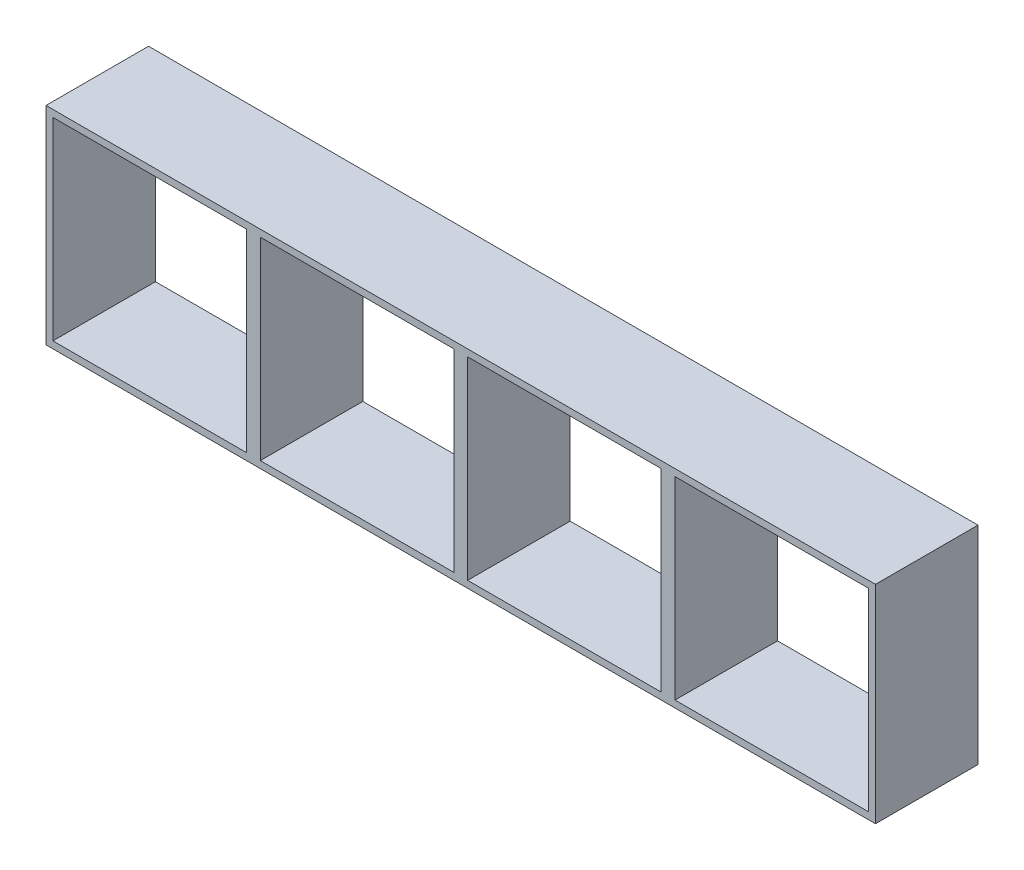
SolidWorks part; units mm, degrees
ref_plane "Plan de face" through (0, 0, 0) normal (0, 0, 1) x (1, 0, 0)
ref_plane "Plan de dessus" through (0, 0, 0) normal (0, 1, 0) x (1, 0, 0)
ref_plane "Plan de droite" through (0, 0, 0) normal (1, 0, 0) x (0, 0, -1)
sketch "Esquisse1" plane through (0, 0, 0) normal (0, 0, 1) x (1, 0, 0)
  line L0 (0, 0) -> (0, 30)
  line L16 (59, 1) -> (59, 29)
  line L17 (59, 29) -> (31, 29)
  line L18 (31, 29) -> (31, 1)
  line L20 (29, 1) -> (29, 29)
  line L21 (29, 29) -> (1, 29)
  line L22 (1, 29) -> (1, 1)
  line L24 (0, 30) -> (120, 30)
  line L25 (60, 30) -> (60, 1) construction
  line L27 (119, 29) -> (119, 1)
  line L28 (91, 29) -> (119, 29)
  line L29 (91, 1) -> (91, 29)
  line L31 (89, 29) -> (89, 1)
  line L32 (61, 29) -> (89, 29)
  line L33 (61, 1) -> (61, 29)
  line L34 (120, 0) -> (120, 30)
  line L35 (0, 0) -> (120, 0)
  line L36 (1, 1) -> (29, 1)
  line L37 (29, 29) -> (31, 29) construction
  line L38 (59, 29) -> (61, 29) construction
  line L39 (89, 29) -> (91, 29) construction
  line L41 (119, 1) -> (120, 1) construction
  line L42 (91, 1) -> (119, 1)
  line L43 (61, 1) -> (89, 1)
  line L44 (31, 1) -> (59, 1)
  dimension "D1" = 1
  dimension "D2" = 1
  dimension "D3" = 2
  dimension "D4" = 30
  dimension "D5" = 1
  dimension "D6" = 28
  dimension "D7" = 28
extrude "Boss.-Extru.1" add sketch "Esquisse1" along normal blind 14.8333 contours L0 L35 L34 L24 L44 L18 L17 L16 L43 L33 L32 L31 L42 L29 L28 L27 L36 L22 L21 L20
